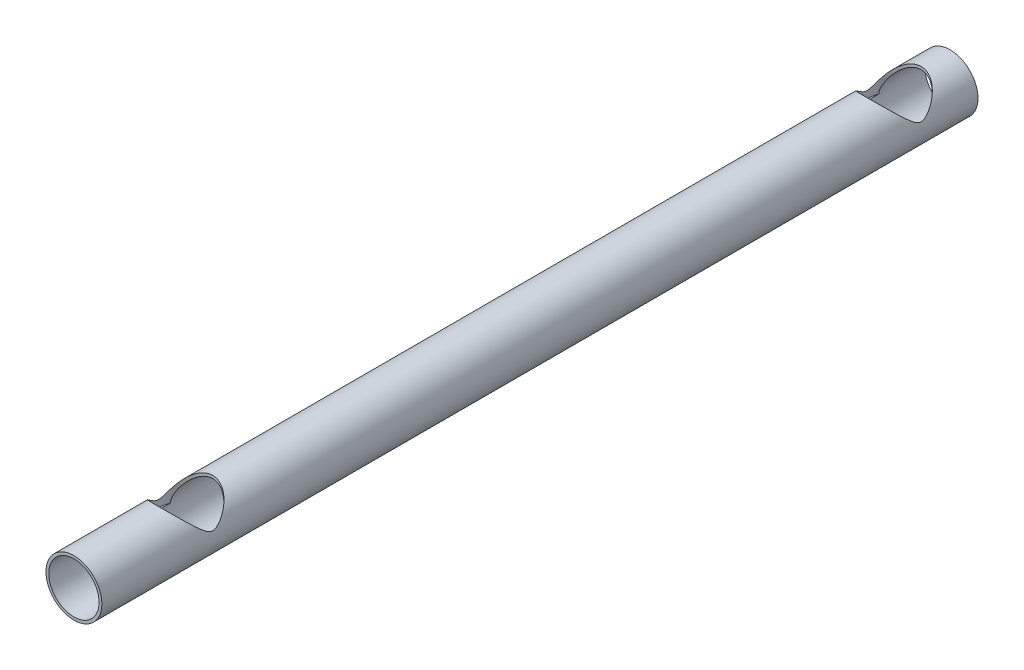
SolidWorks part; units mm, degrees
ref_plane "Plan de face" through (0, 0, 0) normal (0, 0, 1) x (1, 0, 0)
ref_plane "Plan de dessus" through (0, 0, 0) normal (0, 1, 0) x (1, 0, 0)
ref_plane "Plan de droite" through (0, 0, 0) normal (1, 0, 0) x (0, 0, -1)
sketch "Esquisse2" plane through (0, 0, 0) normal (0, 0, 1) x (1, 0, 0)
  circle A0 centre (0, 0) radius 15
  circle A1 centre (0, 0) radius 13.5
  dimension "D1" = 30
  dimension "D2" = 27
extrude "Extrusion1" add sketch "Esquisse2" along normal blind 470
ref_plane "Plan1" through (0, 15, 0) normal (0, 1, 0) x (-1, 0, 0)
sketch "Esquisse3" plane through (0, 15, 0) normal (0, 1, 0) x (-1, 0, 0)
  line L1 (-15, 0) -> (15, 0) construction
  line L2 (15, 470) -> (-15, 470) construction
  line L3 (0, -33.7949) -> (0, 94.6193) construction
  line L4 (0, 543.7501) -> (0, 342.2694) construction
  circle A0 centre (0, 30) radius 14.5
  circle A1 centre (0, 410) radius 14.5
  dimension "D2" = 29
  dimension "D4" = 29
  dimension "D1" = 30
  dimension "D3" = 60
extrude "Extrusion4" cut sketch "Esquisse3" against normal blind 15
